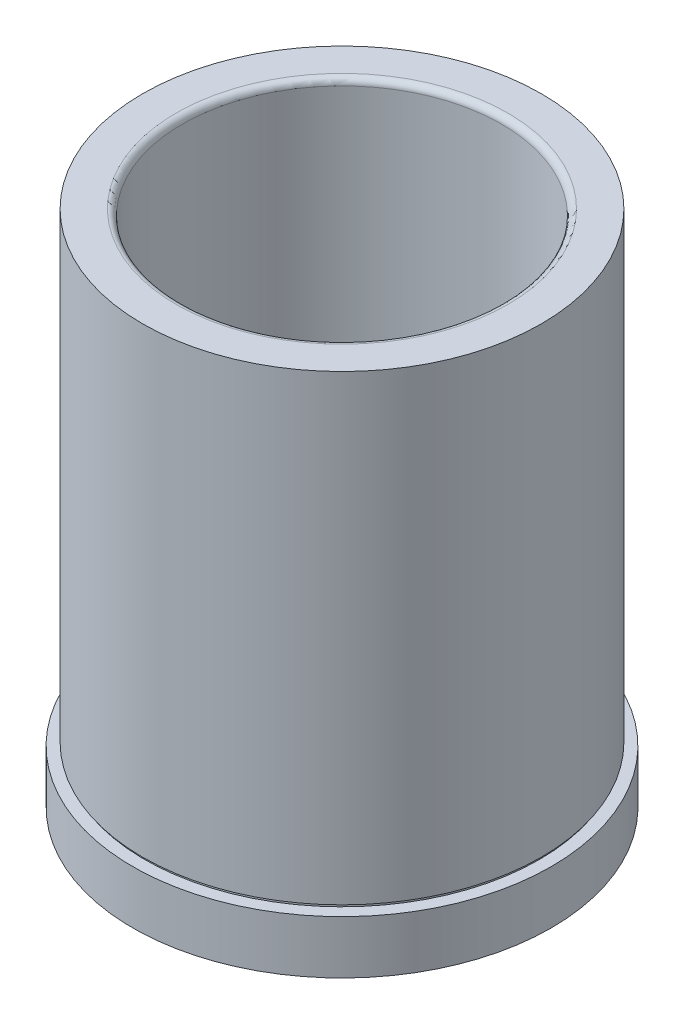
SolidWorks part; units mm, degrees
ref_plane "Front Plane" through (0, 0, 0) normal (0, 0, 1) x (1, 0, 0)
ref_plane "Top Plane" through (0, 0, 0) normal (0, 1, 0) x (1, 0, 0)
ref_plane "Right Plane" through (0, 0, 0) normal (1, 0, 0) x (0, 0, -1)
sketch "Sketch1" plane through (0, 0, 0) normal (0, 0, 1) x (1, 0, 0)
  line L0 (-977.1194, 311.2267) -> (46664.5886, -14863.346) construction
  line L1 (0, -1000) -> (0, 49000) construction
  line L2 (-38.1064, 139.7507) -> (-38.1063, 16.7417)
  line L3 (-38.9224, 15.9257) -> (-49.9999, 15.9257)
  line L4 (-49.9999, 15.9257) -> (-49.9999, 28.6257)
  line L5 (-49.9999, 28.6257) -> (-47.1233, 28.6257)
  line L6 (-47.6314, 139.7507) -> (-47.6313, 29.3877)
  line L7 (-47.6314, 139.7507) -> (-38.1064, 139.7507)
  line L8 (-38.9224, 15.9257) -> (-38.1063, 16.7417)
  line L10 (-47.6313, 29.3877) -> (-47.1233, 29.3877)
  line L11 (-47.1233, 29.3877) -> (-47.1233, 28.6257)
  dimension "D1" = 0.508
  dimension "OD" = 95.2627
  dimension "ID" = 76.2127
  dimension "FLANGETHICKNESS" = 12.7
  dimension "FLANGEDIA" = 99.9998
  dimension "D2" = 45
  dimension "D3" = 0.762
  dimension "OVERALL LENGTH" = 123.825
revolve "Revolve1" add sketch "Sketch1" angle 360 about L1
fillet "Fillet1" radius 1.524 1 edges at (38.1063, 139.7507, 0)
